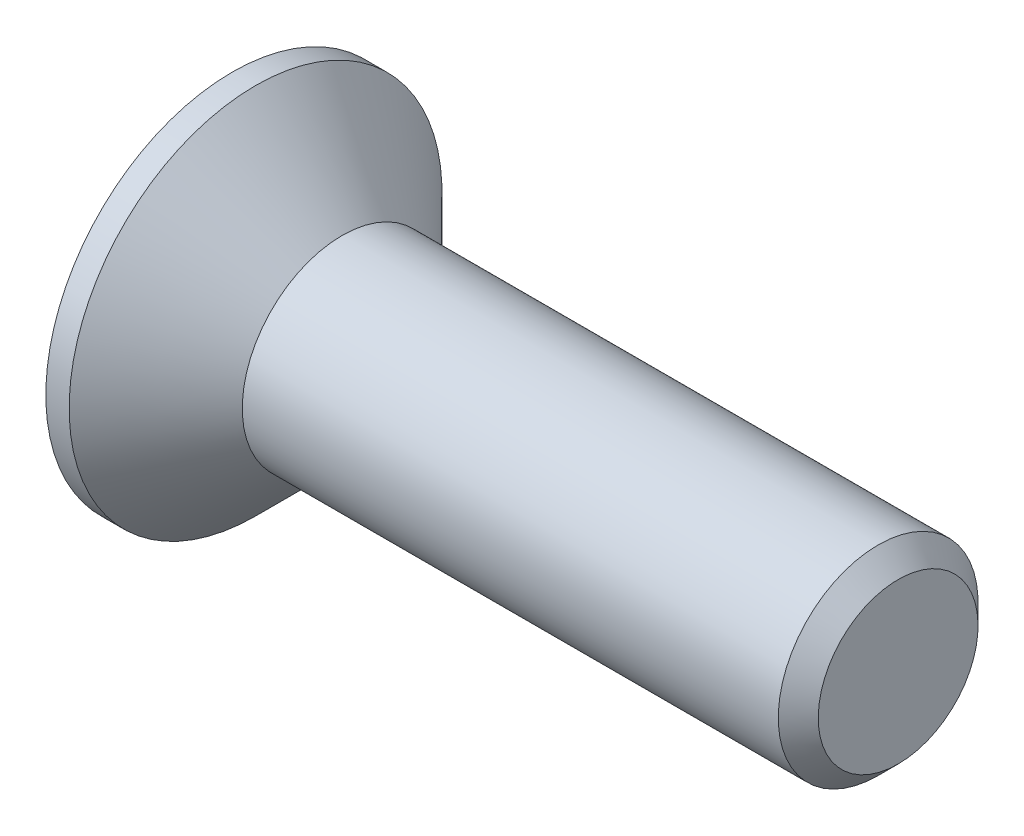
SolidWorks part; units mm, degrees
ref_plane "Front Plane" through (0, 0, 0) normal (0, 0, 1) x (1, 0, 0)
ref_plane "Top Plane" through (0, 0, 0) normal (0, 1, 0) x (1, 0, 0)
ref_plane "Right Plane" through (0, 0, 0) normal (1, 0, 0) x (0, 0, -1)
sketch "Sketch1" plane through (0, 0, 0) normal (0, 0, 1) x (1, 0, 0)
  line L1 (-1.65, 2.8) -> (-1.65, 0)
  line L2 (-1.65, 0) -> (8.35, 0)
  line L3 (8.35, 0) -> (8.35, 1.5)
  line L4 (8.35, 1.5) -> (0, 1.5)
  line L5 (-1.65, 2.8) -> (-1.3, 2.8)
  line L6 (-1.3, 2.8) -> (0, 1.5)
  dimension "D1" = 1.5
  dimension "D2" = 45
  dimension "D3" = 1.65
  dimension "D4" = 10
  dimension "D5" = 2.8
revolve "Revolve1" add sketch "Sketch1" angle 360 about L2
chamfer "Chamfer1" distance 0.3 angle 45 1 edges at (8.35, -1.5, 0)
sketch "Sketch2" plane through (-1.65, 0, 0) normal (-1, 0, 0) x (0, 0, 1)
  line L0 (-0.365, 1.45) -> (0.365, 1.45)
  line L1 (0.365, 1.45) -> (0.365, 0.365)
  line L2 (0.365, 0.365) -> (1.45, 0.365)
  line L3 (1.45, 0.365) -> (1.45, -0.365)
  line L4 (1.45, -0.365) -> (0.365, -0.365)
  line L5 (0.365, -0.365) -> (0.365, -1.45)
  line L6 (0.365, -1.45) -> (-0.365, -1.45)
  line L7 (-0.365, -1.45) -> (-0.365, -0.365)
  line L8 (-0.365, -0.365) -> (-1.45, -0.365)
  line L9 (-1.45, -0.365) -> (-1.45, 0.365)
  line L10 (-1.45, 0.365) -> (-0.365, 0.365)
  line L11 (-0.365, 0.365) -> (-0.365, 1.45)
  point P2 (0, 1.45)
  point P14 (0, -1.45)
  point P15 (1.45, 0)
  point P16 (-1.45, 0)
  dimension "D1" = 2.9
  dimension "D2" = 0.73
extrude "Cut-Extrude1" cut sketch "Sketch2" against normal blind 1.25
